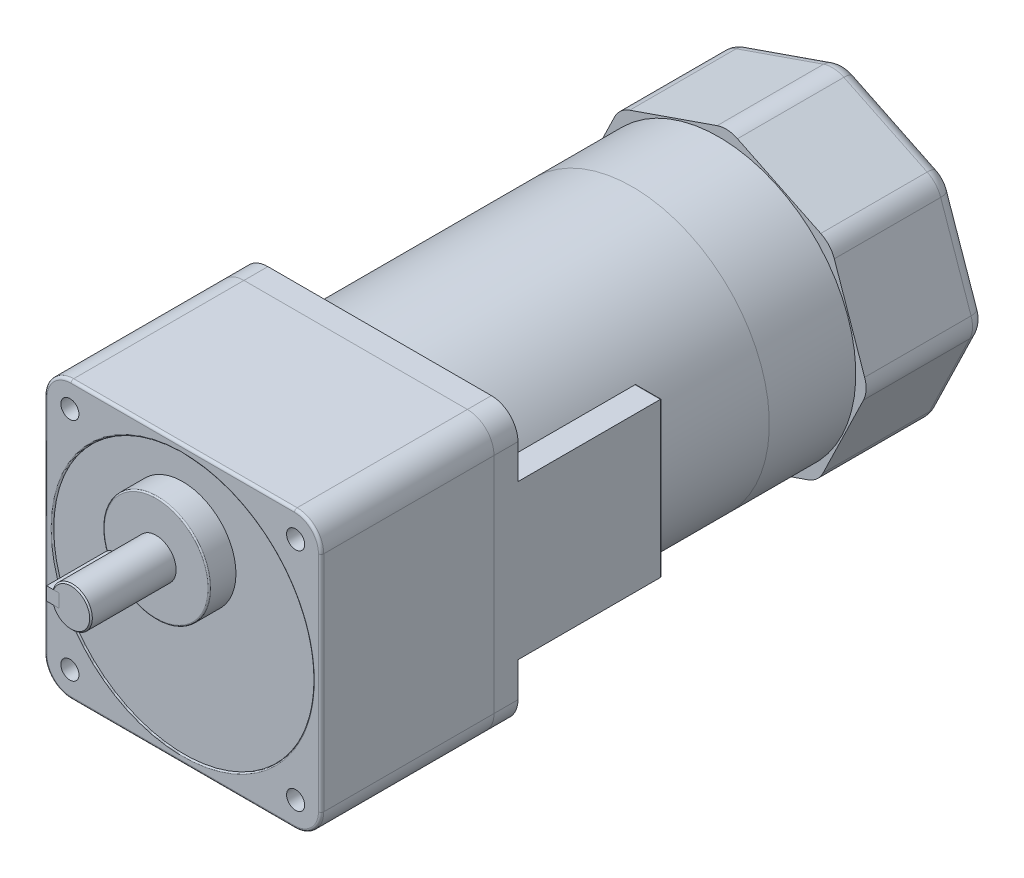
SolidWorks part; units mm, degrees
ref_plane "前视基准面" through (0, 0, 0) normal (0, 0, 1) x (1, 0, 0)
ref_plane "上视基准面" through (0, 0, 0) normal (0, 1, 0) x (1, 0, 0)
ref_plane "右视基准面" through (0, 0, 0) normal (1, 0, 0) x (0, 0, -1)
sketch "草图1" plane through (0, 0, 0) normal (0, 0, 1) x (1, 0, 0)
  line L1 (-42, -52) -> (42, -52)
  line L2 (-52, -42) -> (-52, 42)
  line L3 (-42, 52) -> (42, 52)
  line L4 (52, -42) -> (52, 42)
  line L5 (-52, -52) -> (52, 52) construction
  line L6 (-52, 52) -> (52, -52) construction
  arc A0 (-42, -52) -> (-52, -42) centre (-42, -42) cw
  arc A1 (-52, 42) -> (-42, 52) centre (-42, 42) cw
  arc A2 (42, 52) -> (52, 42) centre (42, 42) cw
  arc A3 (42, -52) -> (52, -42) centre (42, -42) ccw
  point P0 (0, 0)
  dimension "D1" = 10
extrude "凸台-拉伸1" add sketch "草图1" along normal blind 65
sketch "草图2" plane through (0, 0, 0) normal (0, 0, -1) x (-1, 0, 0)
  line L0 (52, 42) -> (52, -42) construction
  line L1 (-42, 52) -> (42, 52)
  line L2 (-52, 42) -> (-52, -42)
  line L3 (-42, -52) -> (42, -52)
  line L4 (52, 42) -> (52, -42)
  line L5 (-52, 52) -> (52, -52) construction
  line L6 (-52, -52) -> (52, 52) construction
  arc A0 (42, -52) -> (52, -42) centre (42, -42) ccw
  arc A1 (-52, -42) -> (-42, -52) centre (-42, -42) ccw
  arc A2 (-42, 52) -> (-52, 42) centre (-42, 42) ccw
  arc A3 (42, 52) -> (52, 42) centre (42, 42) cw
  point P0 (0, 0)
  dimension "D1" = 10
extrude "凸台-拉伸2" add sketch "草图2" along normal blind 9 separate body
sketch "草图3" plane through (0, 0, -9) normal (0, 0, -1) x (-1, 0, 0)
  line L0 (-52, 42) -> (-52, -42) construction
  line L1 (0, 29) -> (-52, 29)
  line L3 (0, -29) -> (-52, -29)
  line L4 (-52, 29) -> (-52, -29)
  line L8 (0, 29) -> (0, -29)
  point P0 (0, 0)
extrude "凸台-拉伸3" add sketch "草图3" along normal blind 54
sketch "草图4" plane through (0, 0, -9) normal (0, 0, -1) x (-1, 0, 0)
  circle A0 centre (0, 0) radius 51.5
extrude "凸台-拉伸4" add sketch "草图4" along normal blind 95 separate body
sketch "草图5" plane through (0, 0, -104) normal (0, 0, -1) x (-1, 0, 0)
  circle A0 centre (0, 0) radius 51.5
extrude "凸台-拉伸5" add sketch "草图5" along normal blind 32.5 separate body
sketch "草图6" plane through (0, 0, -136.5) normal (0, 0, -1) x (-1, 0, 0)
  line L1 (-7.0224, 54.3814) -> (-38.3332, 39.2074)
  line L2 (-43.419, 33.4879) -> (-54.8295, 0.6182)
  line L3 (-54.3814, -7.0224) -> (-39.2074, -38.3332)
  line L4 (-33.4879, -43.419) -> (-0.6182, -54.8295)
  line L5 (7.0224, -54.3814) -> (38.3332, -39.2074)
  line L6 (43.419, -33.4879) -> (54.8295, -0.6182)
  line L7 (54.3814, 7.0224) -> (39.2074, 38.3332)
  line L8 (33.4879, 43.419) -> (0.6182, 54.8295)
  circle A0 centre (0, 0) radius 52 construction
  arc A1 (-54.8295, 0.6182) -> (-54.3814, -7.0224) centre (-45.3825, -2.6612) ccw
  arc A2 (-39.2074, -38.3332) -> (-33.4879, -43.419) centre (-30.2085, -33.9721) ccw
  arc A3 (-0.6182, -54.8295) -> (7.0224, -54.3814) centre (2.6612, -45.3825) ccw
  arc A4 (38.3332, -39.2074) -> (43.419, -33.4879) centre (33.9721, -30.2085) ccw
  arc A5 (54.8295, -0.6182) -> (54.3814, 7.0224) centre (45.3825, 2.6612) ccw
  arc A6 (39.2074, 38.3332) -> (33.4879, 43.419) centre (30.2085, 33.9721) ccw
  arc A7 (-7.0224, 54.3814) -> (0.6182, 54.8295) centre (-2.6612, 45.3825) cw
  arc A8 (-38.3332, 39.2074) -> (-43.419, 33.4879) centre (-33.9721, 30.2085) ccw
  dimension "D1" = 10
extrude "凸台-拉伸6" add sketch "草图6" along normal blind 45 separate body
fillet "圆角1" radius 5 16 edges at (49.1243, 17.0531, -181.5) (41.4449, 36.8535, -181.5) (22.6778, 46.7944, -181.5) (3.2466, 55.3654, -181.5) (-17.0531, 49.1243, -181.5) (-36.8535, 41.4449, -181.5) (-46.7944, 22.6778, -181.5) (-55.3654, 3.2466, -181.5) (-49.1243, -17.0531, -181.5) (-41.4449, -36.8535, -181.5) (-22.6778, -46.7944, -181.5) (-3.2466, -55.3654, -181.5) (17.0531, -49.1243, -181.5) (36.8535, -41.4449, -181.5) (46.7944, -22.6778, -181.5) (55.3654, -3.2466, -181.5)
fillet "圆角2" radius 1 8 edges at (-52, 0, 65) (-49.0711, 49.0711, 65) (0, 52, 65) (49.0711, 49.0711, 65) (52, 0, 65) (49.0711, -49.0711, 65) (0, -52, 65) (-49.0711, -49.0711, 65)
fillet "圆角3" radius 0.5 3 edges at (26, -29, -63) (26, 29, -63) (52, 0, -63)
sketch "草图7" plane through (0, 0, 65) normal (0, 0, 1) x (1, 0, 0)
  point P19 (-42.4264, 42.4264)
  point P20 (-42.4264, -42.4264)
  point P21 (42.4264, -42.4264)
  point P22 (42.4264, 42.4264)
sketch "草图9" plane through (0, 0, -9) normal (0, 0, -1) x (-1, 0, 0)
  circle A5 centre (-42.4264, -42.4264) radius 4.5
  circle A6 centre (42.4264, -42.4264) radius 4.5
  circle A7 centre (-42.4264, 42.4264) radius 4.5
  circle A8 centre (42.4264, 42.4264) radius 4.5
extrude "切除-拉伸1" cut sketch "草图9" against normal blind 51.75
hole_wizard "M8 螺纹孔2" positions "3D草图4" profile "草图11" tap size "M8" standard "GB"
sketch3d "3D草图4"
  point P0 (-42.4264, 42.4264, 65)
  point P3 (42.4264, 42.4264, 65)
  point P6 (42.4264, -42.4264, 65)
  point P9 (-42.4264, -42.4264, 65)
sketch "草图11" plane through (-42.4264, 42.4264, 65) normal (1, 0, 0) x (0, -1, 0)
  line L0 (0, 0) -> (0, 24.2929)
  line L1 (0, 24.2929) -> (3.4, 22.25)
  line L2 (3.4, 22.25) -> (3.4, 0)
  line L5 (3.4, 0) -> (0, 0)
  line L10 (0, 24.2929) -> (-3.4, 22.25) construction
  line L11 (0, -6.35) -> (0, 107.95) construction
  dimension "螺纹孔钻头直径" = 6.8
  dimension "螺纹孔钻头深度" = 22.25
  dimension "导头角度" = 118
sketch "草图12" plane through (0, 0, 65) normal (0, 0, 1) x (1, 0, 0)
  circle A0 centre (0, 20) radius 20
extrude "凸台-拉伸7" add sketch "草图12" along normal blind 10 separate body
fillet "圆角4" radius 0.5 1 edges at (20, 20, 75)
sketch "草图13" plane through (0, 0, 75) normal (0, 0, 1) x (1, 0, 0)
  circle A0 centre (0, 20) radius 7.5
extrude "凸台-拉伸8" add sketch "草图13" along normal blind 32 separate body
ref_plane "基准面1" through (-7.5, 0, 0) normal (1, 0, 0) x (0, 0, -1)
chamfer "倒角2" distance 0.5 angle 45 1 edges at (7.5, 20, 107)
sketch "草图16" plane through (0, 0, 65) normal (0, 0, 1) x (1, 0, 0)
  circle A0 centre (0, 0) radius 49
extrude "切除-拉伸3" cut sketch "草图16" against normal blind 0.5
fillet "圆角5" radius 0.5 1 edges at (49, 0, 65)
sketch "草图19" plane through (-7.5, 0, 0) normal (1, 0, 0) x (0, 0, -1)
  line L1 (-107, 27) -> (-107, 13) construction
  line L2 (-84.5, 22.5) -> (-107, 22.5)
  line L3 (-107, 22.5) -> (-107, 17.5)
  line L4 (-107, 17.5) -> (-84.5, 17.5)
  arc A0 (-84.5, 17.5) -> (-84.5, 22.5) centre (-84.5, 20) ccw
extrude "切除-拉伸4" cut sketch "草图19" along normal blind 3
sketch "草图20" plane through (-4.5, 0, 0) normal (-1, 0, 0) x (0, 0, 1)
  line L0 (84.5, 22.5) -> (107, 22.5)
  line L1 (107, 22.5) -> (107, 17.5)
  line L2 (107, 17.5) -> (84.5, 17.5)
  arc A0 (84.5, 22.5) -> (84.5, 17.5) centre (84.5, 20) ccw
extrude "凸台-拉伸9" add sketch "草图20" along normal blind 5 separate body
chamfer "倒角3" distance 0.3 angle 45 4 edges at (-9.5, 22.5, 95.75) (-9.5, 20, 107) (-9.5, 17.5, 95.75) (-9.5, 20, 82)
